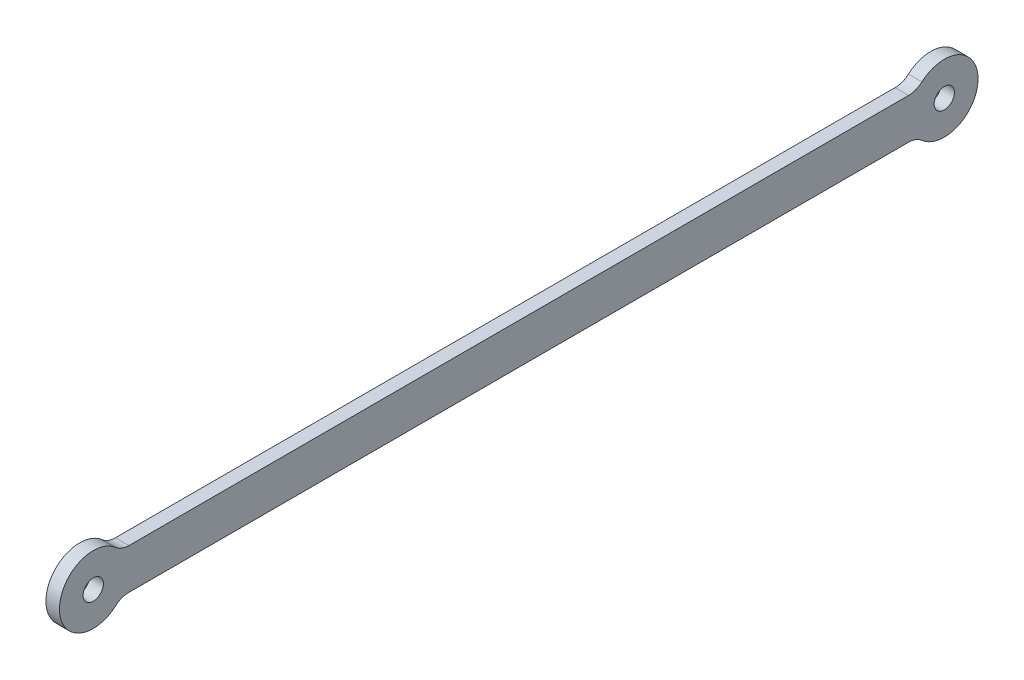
SolidWorks part; units mm, degrees
ref_plane "Front Plane" through (0, 0, 0) normal (0, 0, 1) x (1, 0, 0)
ref_plane "Top Plane" through (0, 0, 0) normal (0, 1, 0) x (1, 0, 0)
ref_plane "Right Plane" through (0, 0, 0) normal (1, 0, 0) x (0, 0, -1)
sketch "Sketch1" plane through (0, 0, 0) normal (1, 0, 0) x (0, 0, -1)
  line L0 (0, 0) -> (-126, 0) construction
  line L1 (0, -3) -> (-126, -3)
  line L2 (0, 3) -> (-126, 3)
  arc A0 (0, -3) -> (0, 3) centre (0, 0) ccw
  arc A1 (-126, 3) -> (-126, -3) centre (-126, 0) ccw
  circle A2 centre (-126, 0) radius 1.5
  circle A3 centre (0, 0) radius 1.5
  point P3 (-63, 0)
  dimension "D1" = 3
  dimension "D2" = 3
  dimension "D3" = 6
  dimension "D4" = 126
extrude "Boss-Extrude1" add sketch "Sketch1" along normal blind 2
sketch "Sketch2" plane through (2, 0, 0) normal (1, 0, 0) x (0, 0, -1)
  circle A0 centre (-126, 0) radius 5
  circle A1 centre (0, 0) radius 5
  circle A2 centre (-126, 0) radius 1.5 construction
  circle A3 centre (0, 0) radius 1.5 construction
  circle A4 centre (-126, 0) radius 1.5
  circle A5 centre (0, 0) radius 1.5
  dimension "D1" = 10
extrude "Boss-Extrude2" add sketch "Sketch2" against normal up to surface (2 mm away)
fillet "Fillet1" radius 3 4 edges at (1, 3, 122) (1, -3, 122) (1, -3, 4) (1, 3, 4)
